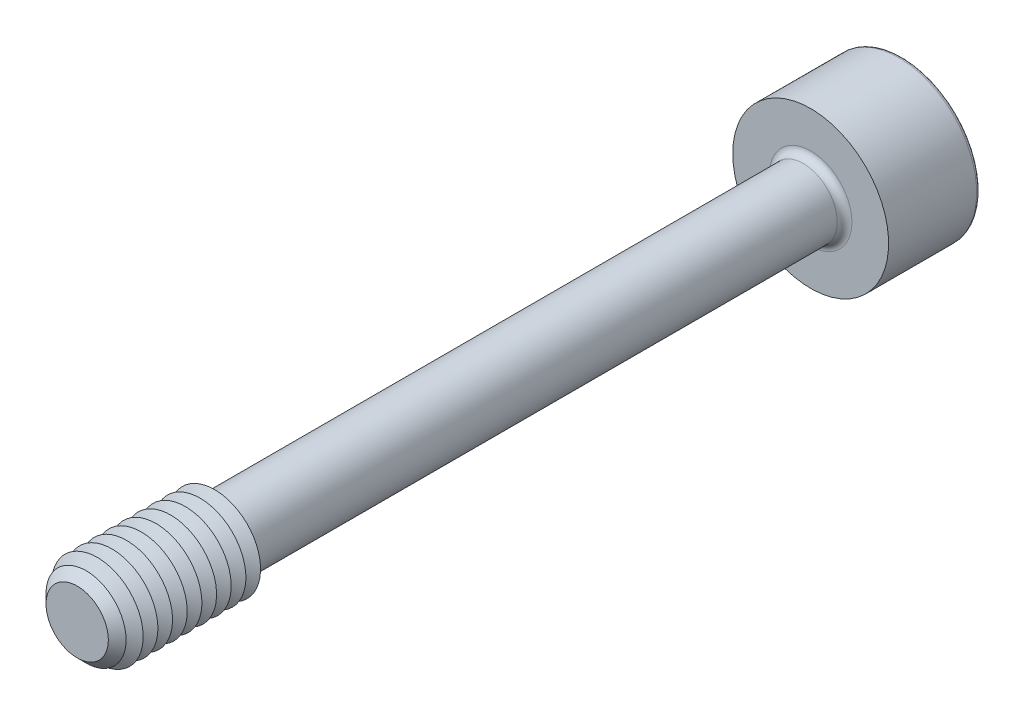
SolidWorks part; units mm, degrees
ref_plane "Front Plane" through (0, 0, 0) normal (0, 0, 1) x (1, 0, 0)
ref_plane "Top Plane" through (0, 0, 0) normal (0, 1, 0) x (1, 0, 0)
ref_plane "Right Plane" through (0, 0, 0) normal (1, 0, 0) x (0, 0, -1)
sketch "Sketch1" plane through (0, 0, 0) normal (0, 0, 1) x (1, 0, 0)
  circle A0 centre (0, 0) radius 1.85
  dimension "D1" = 3.7
extrude "Extrude1" add sketch "Sketch1" along normal mid plane 40
sketch "Sketch2" plane through (0, 0, 0) normal (1, 0, 0) x (0, 0, -1)
  line L0 (-20, 0) -> (-20, 2.5)
  line L1 (-20, 1.85) -> (-20, -1.85) construction
  line L2 (-20, 2.5) -> (-12.5, 2.5)
  line L3 (-12.5, 2.5) -> (-12.1247, 1.85)
  line L4 (20, 1.85) -> (-20, 1.85) construction
  line L5 (-12.1247, 1.85) -> (-12.1247, 0)
  line L6 (-12.1247, 0) -> (-20, 0)
  dimension "D1" = 2.5
  dimension "D2" = 120
  dimension "D3" = 7.5
revolve "Revolve1" add sketch "Sketch2" angle 360 about L6
chamfer "Chamfer1" distance 0.8 angle 45 1 edges at (0, 2.5, 20)
sketch "Sketch3" plane through (0, 0, -20) normal (0, 0, -1) x (-1, 0, 0)
  circle A0 centre (0, 0) radius 4.25
  dimension "D1" = 8.5
extrude "Extrude2" add sketch "Sketch3" along normal blind 5
sketch "Sketch4" plane through (-13.7, 0, -25) normal (0, 0, 1) x (1, 0, 0)
  line L2 (12.5453, -2) -> (14.8547, -2)
  line L3 (14.8547, -2) -> (16.0094, 0)
  line L4 (16.0094, 0) -> (14.8547, 2)
  line L6 (14.8547, 2) -> (12.5453, 2)
  line L7 (12.5453, 2) -> (11.3906, 0)
  line L8 (11.3906, 0) -> (12.5453, -2)
  circle A0 centre (13.7, 0) radius 2 construction
  dimension "D1" = 4
extrude "Extrude3" cut sketch "Sketch4" along normal blind 4
fillet "Fillet1" radius 0.4 1 edges at (-1.85, 0, -20)
fillet "Fillet2" radius 0.2 1 edges at (-4.25, 0, -25)
sketch "Sketch5" plane through (0, 0, 0) normal (1, 0, 0) x (0, 0, -1)
  line L0 (21, 0) -> (21, -2)
  line L1 (21, -2) -> (19.8453, 0)
  line L2 (19.8453, 0) -> (21, 0)
  dimension "D1" = 30
revolve "Cut-Revolve1" cut sketch "Sketch5" angle 360 about L2
sketch "Sketch6" plane through (0, 0, 0) normal (1, 0, 0) x (0, 0, -1)
  line L0 (1.332, 0) -> (-13.289, 0) construction
sketch "Sketch7" plane through (0, 0, 0) normal (1, 0, 0) x (0, 0, -1)
  line L0 (-12.5, 2.5) -> (-12.9, 1.8072)
  line L1 (-12.9, 1.8072) -> (-13.3, 2.5)
  line L2 (-12.5, 2.5) -> (-19.2, 2.5) construction
  line L3 (-13.3, 2.5) -> (-12.5, 2.5)
  dimension "D1" = 0.8
revolve "Cut-Revolve2" cut sketch "Sketch7" angle 360 about L0
pattern_linear "LPattern1" count 9 spacing 0.8 along (0, 0, 1) of "Cut-Revolve2"
